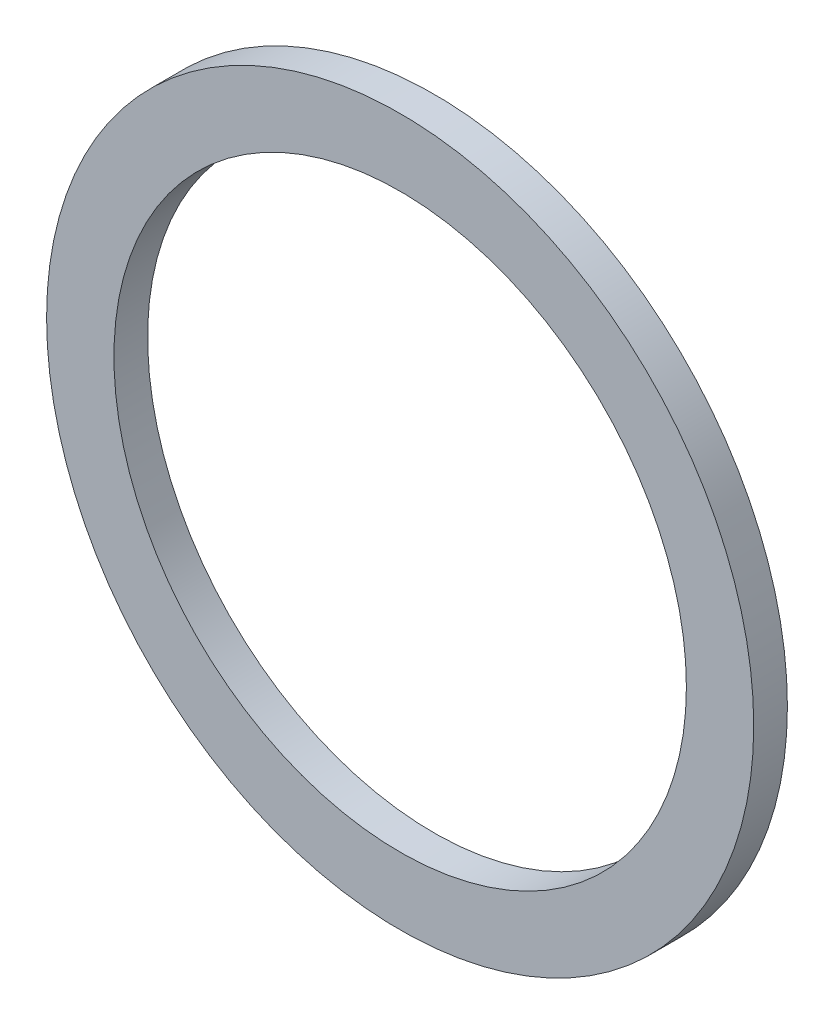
SolidWorks part; units mm, degrees
ref_plane "Спереди" through (0, 0, 0) normal (0, 0, 1) x (1, 0, 0)
ref_plane "Сверху" through (0, 0, 0) normal (0, 1, 0) x (1, 0, 0)
ref_plane "Справа" through (0, 0, 0) normal (1, 0, 0) x (0, 0, -1)
sketch "Sketch1" plane through (0, 0, 0) normal (0, 0, 1) x (1, 0, 0)
  circle A0 centre (0, 0) radius 10.5
  circle A1 centre (0, 0) radius 8.5
  dimension "D1" = 21
  dimension "D2" = 17
extrude "Extrude1" add sketch "Sketch1" along normal blind 1
